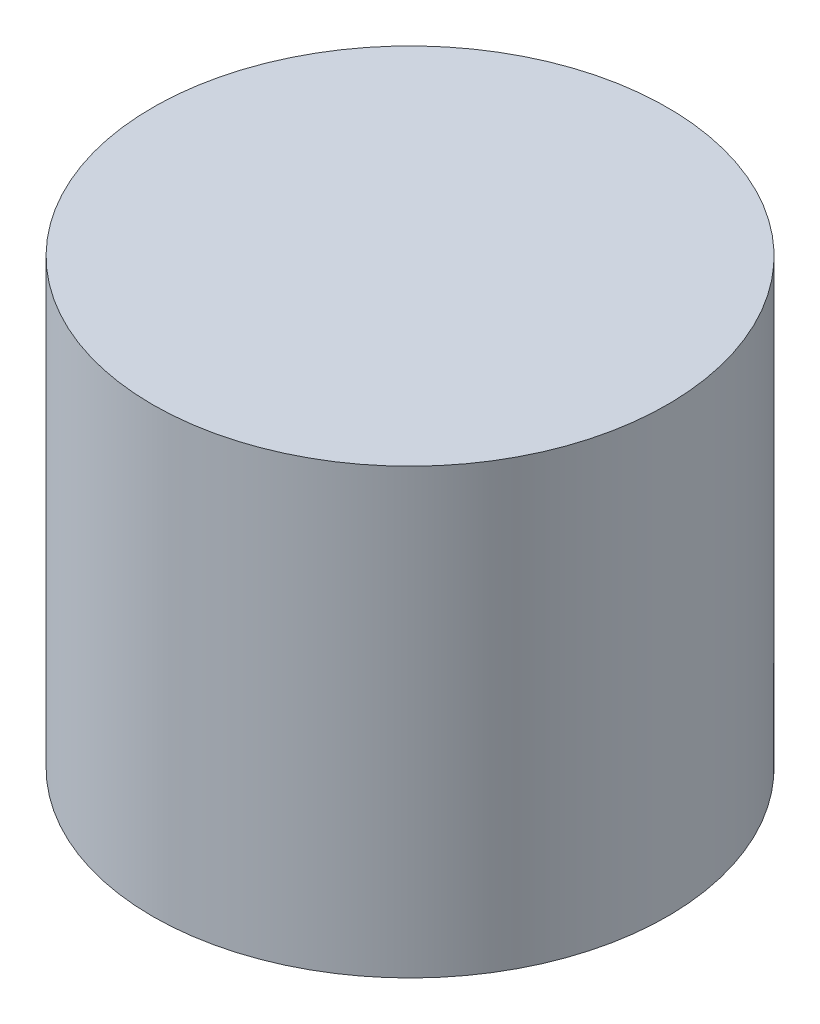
SolidWorks part; units mm, degrees
ref_plane "Front Plane" through (0, 0, 0) normal (0, 0, 1) x (1, 0, 0)
ref_plane "Top Plane" through (0, 0, 0) normal (0, 1, 0) x (1, 0, 0)
ref_plane "Right Plane" through (0, 0, 0) normal (1, 0, 0) x (0, 0, -1)
sketch "Sketch1" plane through (0, 0, 0) normal (0, 1, 0) x (1, 0, 0)
  circle A0 centre (0, 0) radius 16
  dimension "D1" = 32
extrude "Boss-Extrude1" add sketch "Sketch1" along normal blind 27.55
